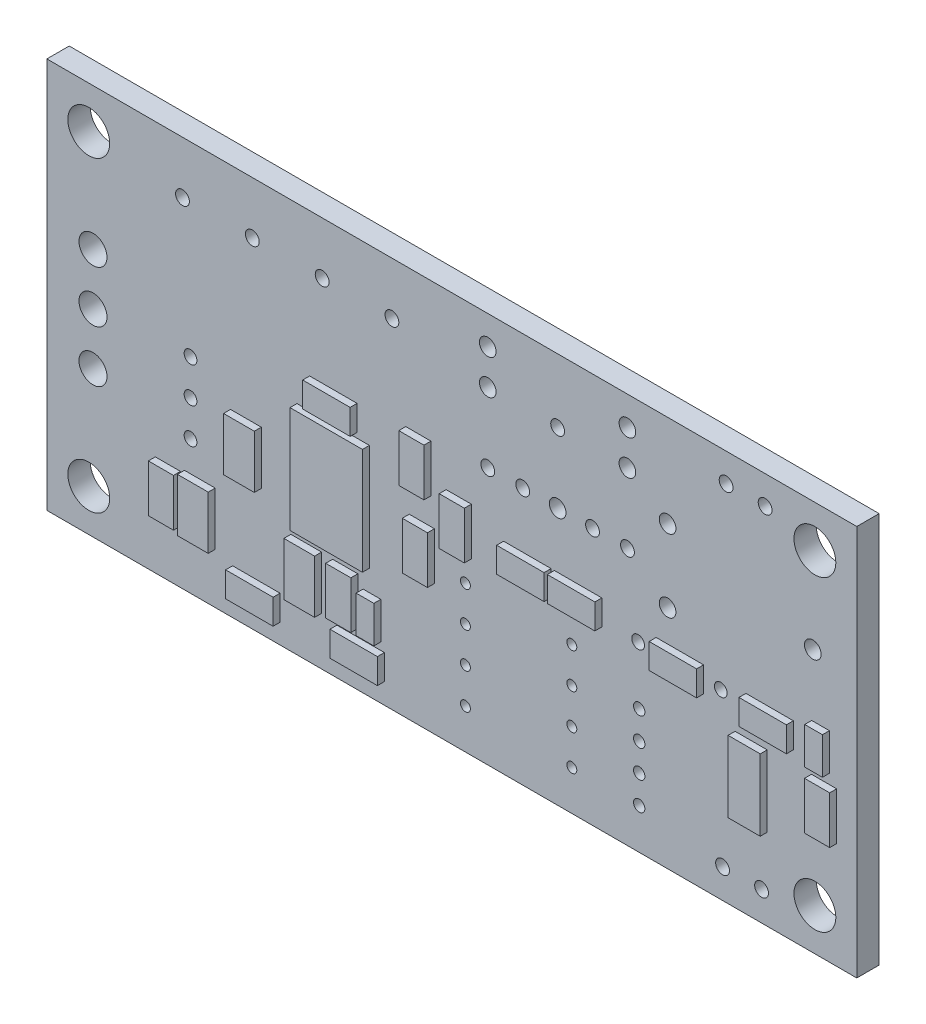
SolidWorks part; units mm, degrees
ref_plane "Plan de face" through (0, 0, 0) normal (0, 0, 1) x (1, 0, 0)
ref_plane "Plan de dessus" through (0, 0, 0) normal (0, 1, 0) x (1, 0, 0)
ref_plane "Plan de droite" through (0, 0, 0) normal (1, 0, 0) x (0, 0, -1)
sketch "PCB DGB" plane through (0, 0, 0) normal (0, 0, 1) x (1, 0, 0)
  line L551 (0, 0) -> (0, 28.001)
  line L552 (0, 28.001) -> (57.9984, 28.001)
  line L553 (57.9984, 28.001) -> (57.9984, 0)
  line L554 (57.9984, 0) -> (0, 0)
  circle A70 centre (51.181, 2.093) radius 0.4953
  circle A71 centre (48.387, 2.093) radius 0.4953
  circle A72 centre (51.435, 25.969) radius 0.4953
  circle A73 centre (48.641, 25.969) radius 0.4953
  circle A74 centre (24.7091, 24.2545) radius 0.4953
  circle A75 centre (19.7129, 24.2545) radius 0.4953
  circle A76 centre (14.7117, 24.2545) radius 0.4953
  circle A77 centre (9.7104, 24.257) radius 0.4953
  circle A78 centre (36.576, 23.429) radius 0.4953
  circle A79 centre (41.5773, 18.4277) radius 0.4953
  circle A80 centre (39.0754, 18.4277) radius 0.4953
  circle A81 centre (31.5722, 18.4277) radius 0.4953
  circle A82 centre (34.0741, 18.4277) radius 0.4953
  circle A83 centre (42.418, 2.9032) radius 0.4064
  circle A84 centre (42.418, 4.9124) radius 0.4064
  circle A85 centre (42.418, 6.8936) radius 0.4064
  circle A86 centre (42.418, 8.9002) radius 0.4064
  circle A87 centre (29.972, 10.475) radius 0.3556
  circle A88 centre (29.972, 7.935) radius 0.3556
  circle A89 centre (29.972, 5.395) radius 0.3556
  circle A90 centre (29.972, 2.855) radius 0.3556
  circle A91 centre (37.592, 2.855) radius 0.3556
  circle A92 centre (37.592, 5.395) radius 0.3556
  circle A93 centre (37.592, 7.935) radius 0.3556
  circle A94 centre (37.592, 10.475) radius 0.3556
  circle A95 centre (54.8488, 18.796) radius 0.5969
  circle A96 centre (44.45, 21.3995) radius 0.5969
  circle A97 centre (44.45, 16.2001) radius 0.5969
  circle A98 centre (36.576, 18.4277) radius 0.5969
  circle A99 centre (41.5722, 23.429) radius 0.5969
  circle A100 centre (31.5722, 23.429) radius 0.5969
  circle A101 centre (41.5722, 25.9283) radius 0.5969
  circle A102 centre (31.5722, 25.9283) radius 0.5969
  circle A103 centre (42.3418, 13.015) radius 0.4572
  circle A104 centre (48.26, 13.015) radius 0.4572
  circle A105 centre (10.287, 9.586) radius 0.4572
  circle A106 centre (10.287, 12.126) radius 0.4572
  circle A107 centre (10.287, 14.666) radius 0.4572
  circle A108 centre (3.302, 17.841) radius 1.0033
  circle A109 centre (3.302, 14.1402) radius 1.0033
  circle A110 centre (3.302, 10.4419) radius 1.0033
  circle A136 centre (54.9986, 25.0012) radius 1.4986
  circle A137 centre (54.9986, 2.9997) radius 1.4986
  circle A138 centre (2.9997, 2.9997) radius 1.4986
  circle A139 centre (2.9997, 25.0012) radius 1.4986
extrude "Boss.-Extru.1" add sketch "PCB DGB" along normal blind 1.6
sketch "Esquisse2" plane through (0, 0, 1.6) normal (0, 0, 1) x (1, 0, 0)
  line L0 (53.4576, 11.8816) -> (50.0591, 11.8816)
  line L1 (50.0591, 11.8816) -> (50.0591, 13.6825)
  line L2 (50.0591, 13.6825) -> (53.4576, 13.6825)
  line L3 (53.4576, 13.6825) -> (53.4576, 11.8816)
  line L4 (22.2156, 15.9456) -> (18.8171, 15.9456)
  line L5 (18.8171, 15.9456) -> (18.8171, 17.7465)
  line L6 (18.8171, 17.7465) -> (22.2156, 17.7465)
  line L7 (22.2156, 17.7465) -> (22.2156, 15.9456)
  line L8 (13.3002, 3.2151) -> (16.6987, 3.2151)
  line L9 (16.6987, 3.2151) -> (16.6987, 1.4143)
  line L10 (16.6987, 1.4143) -> (13.3002, 1.4143)
  line L11 (13.3002, 1.4143) -> (13.3002, 3.2151)
  line L12 (23.9148, 6.4435) -> (23.9148, 3.8019)
  line L13 (23.9148, 3.8019) -> (22.6448, 3.8019)
  line L14 (22.6448, 3.8019) -> (22.6448, 6.4435)
  line L15 (22.6448, 6.4435) -> (23.9148, 6.4435)
  line L16 (20.7703, 3.2685) -> (24.1688, 3.2685)
  line L17 (24.1688, 3.2685) -> (24.1688, 1.4676)
  line L18 (24.1688, 1.4676) -> (20.7703, 1.4676)
  line L19 (20.7703, 1.4676) -> (20.7703, 3.2685)
  line L20 (20.4655, 3.8044) -> (20.4655, 7.2029)
  line L21 (20.4655, 7.2029) -> (22.2664, 7.2029)
  line L22 (22.2664, 7.2029) -> (22.2664, 3.8044)
  line L23 (22.2664, 3.8044) -> (20.4655, 3.8044)
  line L24 (7.7655, 3.8044) -> (7.7655, 7.2029)
  line L25 (7.7655, 7.2029) -> (9.5664, 7.2029)
  line L26 (9.5664, 7.2029) -> (9.5664, 3.8044)
  line L27 (9.5664, 3.8044) -> (7.7655, 3.8044)
  line L28 (9.8509, 3.6088) -> (9.8509, 7.4112)
  line L29 (9.8509, 7.4112) -> (12.053, 7.4112)
  line L30 (12.053, 7.4112) -> (12.053, 3.6088)
  line L31 (12.053, 3.6088) -> (9.8509, 3.6088)
  line L32 (17.4709, 3.4514) -> (17.4709, 7.2512)
  line L33 (17.4709, 7.2512) -> (19.673, 7.2512)
  line L34 (19.673, 7.2512) -> (19.673, 3.4514)
  line L35 (19.673, 3.4514) -> (17.4709, 3.4514)
  line L36 (32.7083, 14.4445) -> (36.1068, 14.4445)
  line L37 (36.1068, 14.4445) -> (36.1068, 12.6436)
  line L38 (36.1068, 12.6436) -> (32.7083, 12.6436)
  line L39 (32.7083, 12.6436) -> (32.7083, 14.4445)
  line L40 (39.7416, 12.6436) -> (36.3431, 12.6436)
  line L41 (36.3431, 12.6436) -> (36.3431, 14.4445)
  line L42 (36.3431, 14.4445) -> (39.7416, 14.4445)
  line L43 (39.7416, 14.4445) -> (39.7416, 12.6436)
  line L44 (28.5935, 12.1864) -> (28.5935, 15.5849)
  line L45 (28.5935, 15.5849) -> (30.3944, 15.5849)
  line L46 (30.3944, 15.5849) -> (30.3944, 12.1864)
  line L47 (30.3944, 12.1864) -> (28.5935, 12.1864)
  line L48 (43.6303, 13.9365) -> (47.0288, 13.9365)
  line L49 (47.0288, 13.9365) -> (47.0288, 12.1356)
  line L50 (47.0288, 12.1356) -> (43.6303, 12.1356)
  line L51 (43.6303, 12.1356) -> (43.6303, 13.9365)
  line L52 (49.2818, 10.9418) -> (49.2818, 5.8313)
  line L53 (49.2818, 5.8313) -> (51.5831, 5.8313)
  line L54 (51.5831, 5.8313) -> (51.5831, 10.9418)
  line L55 (51.5831, 10.9418) -> (49.2818, 10.9418)
  line L56 (54.7555, 7.6144) -> (54.7555, 11.0129)
  line L57 (54.7555, 11.0129) -> (56.5564, 11.0129)
  line L58 (56.5564, 11.0129) -> (56.5564, 7.6144)
  line L59 (56.5564, 7.6144) -> (54.7555, 7.6144)
  line L60 (54.7682, 11.7165) -> (54.7682, 14.3581)
  line L61 (54.7682, 14.3581) -> (56.0382, 14.3581)
  line L62 (56.0382, 14.3581) -> (56.0382, 11.7165)
  line L63 (56.0382, 11.7165) -> (54.7682, 11.7165)
  line L64 (17.9103, 15.5799) -> (17.9103, 7.9599)
  line L65 (17.9103, 7.9599) -> (23.0944, 7.9599)
  line L66 (23.0944, 7.9599) -> (23.0944, 15.5799)
  line L67 (23.0665, 15.5799) -> (23.0944, 15.5799)
  line L68 (23.0665, 15.5799) -> (17.9103, 15.5799)
  line L69 (27.5013, 18.0487) -> (27.5013, 14.6502)
  line L70 (27.5013, 14.6502) -> (25.7005, 14.6502)
  line L71 (25.7005, 14.6502) -> (25.7005, 18.0487)
  line L72 (25.7005, 18.0487) -> (27.5013, 18.0487)
  line L73 (13.1529, 9.0394) -> (13.1529, 12.8392)
  line L74 (13.1529, 12.8392) -> (15.355, 12.8392)
  line L75 (15.355, 12.8392) -> (15.355, 9.0394)
  line L76 (15.355, 9.0394) -> (13.1529, 9.0394)
  line L77 (25.9519, 9.3416) -> (25.9519, 12.7401)
  line L78 (25.9519, 12.7401) -> (27.7528, 12.7401)
  line L79 (27.7528, 12.7401) -> (27.7528, 9.3416)
  line L80 (27.7528, 9.3416) -> (25.9519, 9.3416)
extrude "Boss.-Extru.2" add sketch "Esquisse2" along normal blind 0.5
